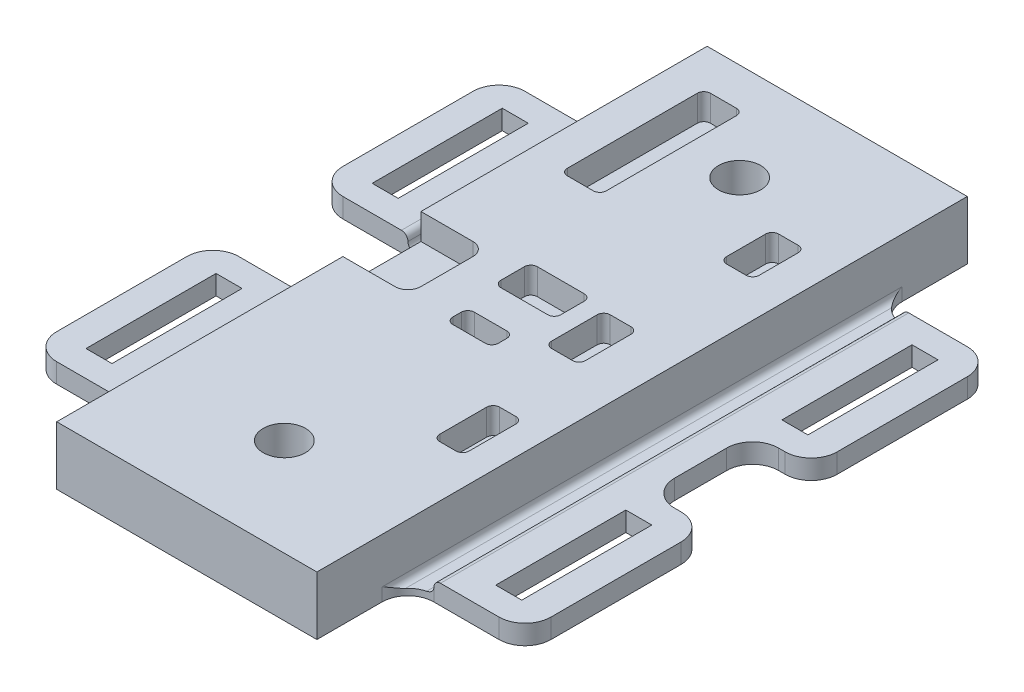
SolidWorks part; units mm, degrees
ref_plane "Front Plane" through (0, 0, 0) normal (0, 0, 1) x (1, 0, 0)
ref_plane "Top Plane" through (0, 0, 0) normal (0, 1, 0) x (1, 0, 0)
ref_plane "Right Plane" through (0, 0, 0) normal (1, 0, 0) x (0, 0, -1)
sketch "Sketch1" plane through (0, 0, 0) normal (0, 1, 0) x (1, 0, 0)
  line L1 (-10, -25) -> (10, -25)
  line L2 (-10, -25) -> (-10, 25)
  line L3 (-10, 25) -> (10, 25)
  line L4 (10, -25) -> (10, 25)
  line L5 (-10, -25) -> (10, 25) construction
  line L6 (-10, 25) -> (10, -25) construction
  point P0 (0, 0)
  dimension "D1" = 20
  dimension "D2" = 50
extrude "Boss-Extrude1" add sketch "Sketch1" along normal blind 4.5
sketch "Sketch2" plane through (0, 0, 0) normal (0, 1, 0) x (1, 0, 0)
  line L0 (-10, 25) -> (-10, -25)
  line L1 (-10, 25) -> (-19, 25)
  line L2 (-10, -25) -> (-19, -25)
  line L3 (-19, 25) -> (-19, -25)
  line L4 (0, 25) -> (0, -25) construction
  line L5 (10, 25) -> (-10, 25) construction
  line L6 (-10, -25) -> (10, -25) construction
  line L7 (10, -25) -> (19, -25)
  line L8 (19, 25) -> (19, -25)
  line L9 (10, 25) -> (19, 25)
  line L10 (10, 25) -> (10, -25)
  dimension "D1" = 9
extrude "Boss-Extrude2" add sketch "Sketch2" along normal blind 0.5
sketch "Sketch5" plane through (0, 0.5, 0) normal (0, 1, 0) x (1, 0, 0)
  line L0 (-19, -25) -> (-10, -25) construction
  line L1 (-19, 25) -> (-12, 25)
  line L2 (-19, 25) -> (-19, -25)
  line L3 (-19, -25) -> (-12, -25)
  line L4 (-12, 25) -> (-12, -25)
  line L5 (0, 25) -> (0, -25) construction
  line L6 (10, 25) -> (-10, 25) construction
  line L7 (-10, -25) -> (10, -25) construction
  line L8 (19, -25) -> (12, -25)
  line L9 (12, 25) -> (12, -25)
  line L10 (19, 25) -> (12, 25)
  line L11 (19, 25) -> (19, -25)
  dimension "D1" = 7
extrude "Boss-Extrude4" add sketch "Sketch5" along normal blind 1
sketch "Sketch6" plane through (0, 4.5, 0) normal (0, 1, 0) x (1, 0, 0)
  line L0 (10, 0) -> (-10, 0) construction
  line L1 (10, -25) -> (10, 25) construction
  line L2 (-10, 25) -> (-10, -25) construction
  line L3 (0, -25) -> (0, 25) construction
  line L4 (-10, -25) -> (10, -25) construction
  line L5 (10, 25) -> (-10, 25) construction
  circle A0 centre (0, 17.5) radius 1.625
  circle A1 centre (0, -17.5) radius 1.625
  dimension "D1" = 3.25
  dimension "D2" = 17.5
extrude "Cut-Extrude3" cut sketch "Sketch6" against normal through all
fillet "Fillet7" radius 0.5 6 edges at (12, 0.5, 0) (10, 0.5, 0) (-10, 0.5, 0) (-12, 0.5, 0) (12, 1.5, 0) (-12, 1.5, 0)
sketch "Sketch7" plane through (0, 0, 0) normal (0, -1, 0) x (1, 0, 0)
  circle A0 centre (0, 0) radius 9.5
  dimension "D1" = 19
extrude "Cut-Extrude4" cut sketch "Sketch7" against normal blind 1.25
sketch "Sketch12" plane through (0, 0, 0) normal (0, -1, 0) x (1, 0, 0)
  line L2 (-4, -8.6168) -> (-4, -7.5)
  line L3 (4, -8.6168) -> (4, -7.5)
  line L10 (-4, 7.5) -> (-4, 8.6168)
  line L11 (4, 7.5) -> (4, 8.6168)
  arc A0 (4, 8.6168) -> (-4, 8.6168) centre (0, 0) ccw
  arc A1 (4, 7.5) -> (-4, 7.5) centre (0, 0) ccw
  circle A2 centre (0, 0) radius 9.5 construction
  circle A3 centre (0, 0) radius 8.5 construction
  circle A4 centre (0, 0) radius 9.5 construction
  arc A7 (-4, -7.5) -> (4, -7.5) centre (0, 0) ccw
  arc A8 (-4, -8.6168) -> (4, -8.6168) centre (0, 0) ccw
  dimension "D2" = 8
  dimension "D1" = 1
extrude "Boss-Extrude5" add sketch "Sketch12" against normal blind 0.25
fillet "Fillet9" radius 0.75 2 edges at (0, 0.25, 9.5) (0, 0.25, -9.5)
fillet "Fillet10" radius 0.5 4 edges at (-4, 0.125, 7.5) (4, 0.125, 7.5) (4, 0.125, -7.5) (-4, 0.125, -7.5)
fillet "Fillet11" radius 0.25 4 edges
sketch "Sketch13" plane through (0, 4.5, 0) normal (0, 1, 0) x (1, 0, 0)
  line L0 (-10, -3) -> (-6, -3)
  line L1 (-10, 25) -> (-10, -25) construction
  line L2 (-5, -2) -> (-5, 2)
  line L3 (-6, 3) -> (-10, 3)
  line L5 (-10, -25) -> (10, -25) construction
  line L9 (10, -25) -> (10, 25) construction
  line L10 (-10, 3) -> (-10, -3)
  line L11 (-10, 0) -> (-5, 0) construction
  line L12 (-4.25, 22) -> (-4.25, 11)
  line L13 (-4.25, 11) -> (-7.25, 11)
  line L14 (-7.25, 11) -> (-7.25, 22)
  line L15 (-7.25, 22) -> (-4.25, 22)
  line L24 (2.25, 3.8) -> (2.25, 1)
  line L25 (2.25, 1) -> (-2.35, 1)
  line L26 (-2.35, 1) -> (-2.35, 3.8)
  line L27 (-2.35, 3.8) -> (2.25, 3.8)
  line L32 (10, 25) -> (-10, 25) construction
  line L33 (3.65, 3.4) -> (6.25, 3.4)
  line L34 (4.75, 11.25) -> (4.75, 15.25)
  line L35 (4.75, 15.25) -> (7.25, 15.25)
  line L37 (7.25, 11.25) -> (4.75, 11.25)
  line L42 (7.25, 15.25) -> (7.25, 11.25)
  line L43 (3.65, 3.4) -> (3.65, -1.1)
  line L44 (3.65, -1.1) -> (6.25, -1.1)
  line L45 (6.25, 3.4) -> (6.25, -1.1)
  line L46 (-1.75, -1.65) -> (1.75, -1.65)
  line L47 (-1.75, -1.65) -> (-1.75, -3.3)
  line L48 (-1.75, -3.3) -> (1.75, -3.3)
  line L49 (1.75, -1.65) -> (1.75, -3.3)
  line L50 (5.55, -7) -> (7.8, -7)
  line L51 (5.55, -7) -> (5.55, -11.6)
  line L52 (5.55, -11.6) -> (7.8, -11.6)
  line L53 (7.8, -7) -> (7.8, -11.6)
  arc A4 (-6, -3) -> (-5, -2) centre (-6, -2) ccw
  arc A5 (-5, 2) -> (-6, 3) centre (-6, 2) ccw
  point P29 (-10, 0)
  point P63 (-7.25, 22)
  point P84 (2.25, 3.8)
  point P87 (2.25, 1)
  point P90 (-2.35, 1)
  point P110 (4.75, 15.25)
  dimension "D2" = 7.75
  dimension "D6" = 3.75
  dimension "D9" = 1
  dimension "D14" = 9.75
  dimension "D18" = 2.6
  dimension "D23" = 8.25
  dimension "D28" = 4.6
  dimension "D3" = 4.6
  dimension "D4" = 21.2
  dimension "D5" = 2.8
  dimension "D7" = 5
  dimension "D8" = 6
  dimension "D10" = 2.75
  dimension "D11" = 3
  dimension "D12" = 3
  dimension "D13" = 14
  dimension "D15" = 4
  dimension "D16" = 2.75
  dimension "D17" = 2.5
  dimension "D19" = 21.6
  dimension "D20" = 4.5
  dimension "D21" = 21.7
  dimension "D22" = 1.65
  dimension "D24" = 3.5
  dimension "D25" = 2.2
  dimension "D26" = 2.25
  dimension "D27" = 13.4
extrude "Cut-Extrude12" cut sketch "Sketch13" against normal blind 2 contours L45 L33 L43 L44 | L49 L46 L47 L48
sketch "Sketch15" plane through (0, 1.5, 0) normal (0, 1, 0) x (1, 0, 0)
  line L0 (0, -17.5) -> (0, 17.5) construction
  line L1 (-19, 0) -> (19, 0) construction
  line L2 (-19, 25) -> (-19, -25) construction
  line L3 (19, -25) -> (19, 25) construction
  line L4 (-14.75, 6) -> (-16.75, 6)
  line L5 (-16.75, 6) -> (-16.75, 16)
  line L6 (-16.75, 16) -> (-14.75, 16)
  line L7 (-14.75, 16) -> (-14.75, 6)
  line L9 (-10, 18) -> (-10, 25)
  line L10 (-10, 25) -> (-19, 25)
  line L11 (-19, 25) -> (-19, 18)
  line L16 (-19, 11) -> (-12.5, 11) construction
  line L17 (-12.5, -25) -> (-12.5, 25) construction
  line L18 (-14.75, 16) -> (-16.75, 6) construction
  line L19 (-10, 25) -> (-10, 3) construction
  line L20 (10, 25) -> (-10, 25) construction
  line L21 (-19, 18) -> (-10, 18)
  line L22 (19, 25) -> (19, 18)
  line L23 (10, 25) -> (19, 25)
  line L24 (10, 18) -> (10, 25)
  line L25 (19, 18) -> (10, 18)
  line L26 (16.75, 16) -> (14.75, 16)
  line L27 (16.75, 6) -> (16.75, 16)
  line L28 (14.75, 6) -> (16.75, 6)
  line L29 (14.75, 16) -> (14.75, 6)
  line L34 (10, -25) -> (19, -25)
  line L35 (10, -18) -> (10, -25)
  line L36 (19, -18) -> (10, -18)
  line L37 (19, -25) -> (19, -18)
  line L38 (16.75, -6) -> (16.75, -16)
  line L39 (14.75, -6) -> (16.75, -6)
  line L40 (14.75, -16) -> (14.75, -6)
  line L41 (16.75, -16) -> (14.75, -16)
  line L43 (-19, -25) -> (-19, -18)
  line L44 (-10, -25) -> (-19, -25)
  line L45 (-10, -18) -> (-10, -25)
  line L46 (-19, -18) -> (-10, -18)
  line L47 (-16.75, -16) -> (-14.75, -16)
  line L48 (-16.75, -6) -> (-16.75, -16)
  line L49 (-14.75, -6) -> (-16.75, -6)
  line L50 (-14.75, -16) -> (-14.75, -6)
  point P29 (-15.75, 11)
  point P31 (-15.75, 11)
  point P55 (10, 0)
  point P64 (-10, 0)
  dimension "D2" = 10
  dimension "D3" = 2
  dimension "D5" = 2
extrude "Cut-Extrude13" cut sketch "Sketch15" against normal through all
sketch "Sketch16" plane through (0, 0, 0) normal (0, -1, 0) x (1, 0, 0)
  line L0 (-7.296, -3) -> (-7.296, 3)
  line L1 (-7.296, 3) -> (-10.5, 3)
  line L3 (-10.5, 3) -> (-10.5, -3)
  line L4 (-10.5, -3) -> (-7.296, -3)
  line L5 (-6, -3) -> (-10, -3) construction
  line L6 (-10, 3) -> (-6, 3) construction
  line L7 (-10, -3) -> (-10, 3) construction
  dimension "D1" = 0.5
extrude "Cut-Extrude14" cut sketch "Sketch16" against normal up to surface (1.25 mm away)
sketch "Sketch17" plane through (0, 1.5, 0) normal (0, 1, 0) x (1, 0, 0)
  line L0 (-19, 4) -> (-14.5, 4)
  line L1 (-19, 18) -> (-19, -18) construction
  line L2 (-14.5, 4) -> (-14.5, -4)
  line L3 (-14.5, -4) -> (-19, -4)
  line L4 (-19, -4) -> (-19, 4)
  line L5 (-14.75, -6) -> (-16.75, -6) construction
  line L6 (-16.75, 6) -> (-14.75, 6) construction
  line L7 (-12.5, -18) -> (-12.5, 18) construction
  line L8 (0, 17.5) -> (0, -17.5) construction
  line L9 (14.5, -4) -> (19, -4)
  line L10 (14.5, 4) -> (14.5, -4)
  line L11 (19, 4) -> (14.5, 4)
  line L12 (19, -4) -> (19, 4)
  dimension "D1" = 2
  dimension "D2" = 2
  dimension "D3" = 2
extrude "Cut-Extrude15" cut sketch "Sketch17" against normal through all
fillet "Fillet15" radius 2 16 edges at (-19, 0.75, 18) (-19, 0.75, 4) (-14.5, 0.75, 4) (-14.5, 0.75, -4) (-19, 0.75, -18) (-19, 0.75, -4) (-10, 0.5, -18) (-10, 0.5, 18) (10, 0.5, -18) (19, 0.75, -18) (19, 0.75, -4) (14.5, 0.75, -4) (14.5, 0.75, 4) (19, 0.75, 4) (19, 0.75, 18) (10, 0.5, 18)
fillet "Fillet16" radius 0.5 24 edges at (5.55, 3.5, 11.6) (7.8, 3.5, 11.6) (7.8, 3.5, 7) (5.55, 3.5, 7) (1.75, 3.5, 3.3) (1.75, 3.5, 1.65) (-1.75, 3.5, 3.3) (-1.75, 3.5, 1.65) (6.25, 3.5, 1.1) (3.65, 3.5, 1.1) (6.25, 3.5, -3.4) (3.65, 3.5, -3.4) (2.25, 3.5, -1) (-2.35, 3.5, -1) (-2.35, 3.5, -3.8) (2.25, 3.5, -3.8) (7.25, 3.5, -11.25) (4.75, 3.5, -11.25) (7.25, 3.5, -15.25) (4.75, 3.5, -15.25) (-4.25, 3.5, -11) (-7.25, 3.5, -11) (-4.25, 3.5, -22) (-7.25, 3.5, -22)
sketch "Sketch18" plane through (0, 1.5, 0) normal (0, 1, 0) x (1, 0, 0)
  line L0 (-17, 4) -> (-10, 4)
  line L1 (-10, 25) -> (-10, 3) construction
  line L2 (-10, 0) -> (0, 0) construction
  line L3 (-14.5, -2) -> (-14.5, 2) construction
  line L4 (-17, 4) -> (-14.5, 0)
  line L6 (-10, 0) -> (-10, 4)
  line L7 (-17, -4) -> (-10, -4)
  line L8 (-17, -4) -> (-14.5, 0)
  line L9 (-10, 0) -> (-10, -4)
  line L10 (-10, 3) -> (-10, -3) construction
extrude "Cut-Extrude16" cut sketch "Sketch18" against normal blind 10
